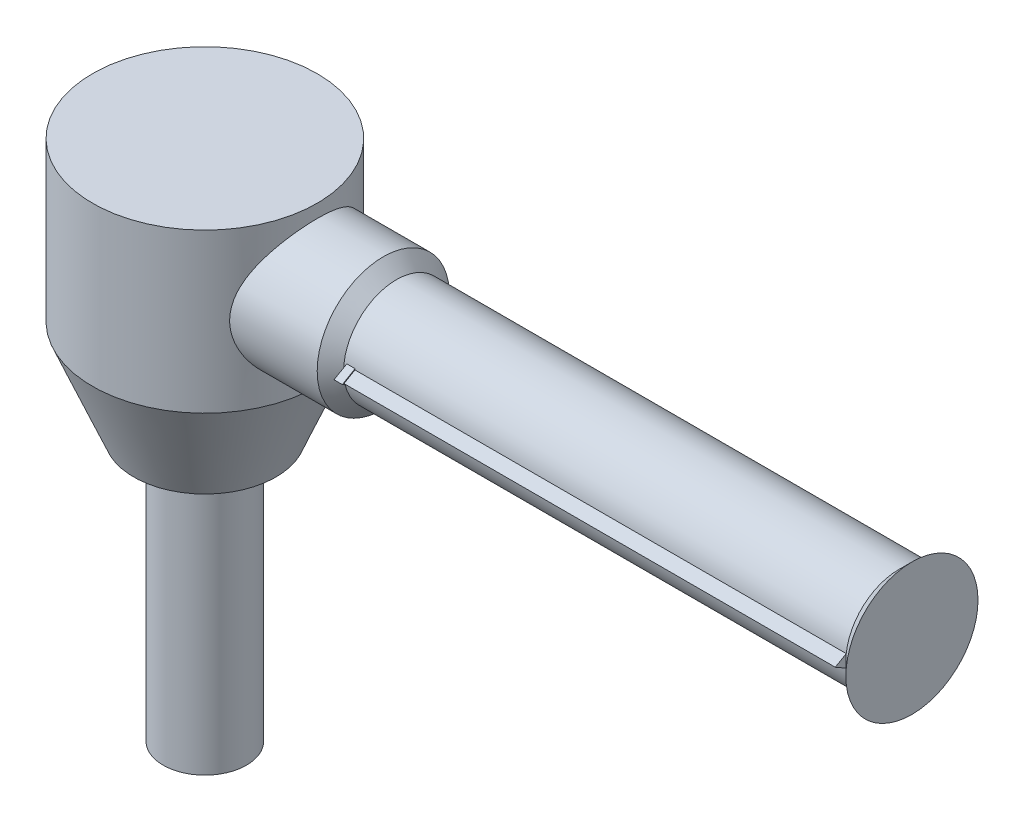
SolidWorks part; units mm, degrees
ref_plane "Front Plane" through (0, 0, 0) normal (0, 0, 1) x (1, 0, 0)
ref_plane "Top Plane" through (0, 0, 0) normal (0, 1, 0) x (1, 0, 0)
ref_plane "Right Plane" through (0, 0, 0) normal (1, 0, 0) x (0, 0, -1)
sketch "Sketch1" plane through (0, 0, 0) normal (0, 0, 1) x (1, 0, 0)
  line L0 (0, 0) -> (0, 61.9125) construction
  line L1 (0, 0) -> (17.0899, 0)
  line L2 (17.0899, 0) -> (26.9875, 23.8125)
  line L3 (26.9875, 23.8125) -> (26.9875, 61.9125)
  line L4 (26.9875, 61.9125) -> (0, 61.9125)
  line L5 (0, 61.9125) -> (0, 0)
  dimension "D1" = 61.9125
  dimension "D2" = 23.8125
  dimension "D3" = 53.975
  dimension "D4" = 34.1797
revolve "Revolve1" add sketch "Sketch1" angle 360 about L0
sketch "Sketch2" plane through (0, 0, 0) normal (0, 0, 1) x (1, 0, 0)
  line L0 (0, 0) -> (0, 61.9125) construction
  line L1 (26.9875, 61.9125) -> (-26.9875, 61.9125) construction
  line L2 (0, 58.7375) -> (42.8625, 58.7375)
  line L3 (42.8625, 58.7375) -> (46.0375, 55.5625)
  line L4 (46.0375, 55.5625) -> (166.6875, 55.5625)
  line L5 (166.6875, 55.5625) -> (169.8625, 58.7375)
  line L6 (0, 42.8625) -> (169.8625, 42.8625)
  line L7 (0, 42.8625) -> (169.8625, 42.8625) construction
  line L8 (0, 42.8625) -> (0, 58.7375)
  line L9 (169.8625, 42.8625) -> (169.8625, 58.7375)
  dimension "D1" = 46.0375
  dimension "D2" = 3.175
  dimension "D3" = 45
  dimension "D5" = 169.8625
  dimension "D6" = 169.8625
  dimension "D7" = 31.75
  dimension "D8" = 19.05
  dimension "D9" = 3.175
revolve "Revolve2" add sketch "Sketch2" angle 360 about L6
sketch "Sketch3" plane through (0, 0, 0) normal (0, -1, 0) x (1, 0, 0)
  circle A0 centre (0, 0) radius 3.2004
  circle A1 centre (0, 0) radius 14.5753
  circle A2 centre (0, 0) radius 11.9845
  circle A3 centre (0, 0) radius 17.0899 construction
  dimension "D1" = 6.4008
  dimension "D2" = 2.5146
  dimension "D3" = 2.5908
extrude "Cut-Extrude1" cut sketch "Sketch3" against normal blind 60.96 contours A1 A2 | A0
sketch "Sketch7" plane through (0, 0, 0) normal (0, -1, 0) x (1, 0, 0)
  circle A0 centre (0, 0) radius 10
  circle A1 centre (0, 0) radius 6
  dimension "D1" = 20
  dimension "D2" = 12
extrude "Boss-Extrude3" add sketch "Sketch7" along normal blind 63.5
ref_plane "Plane1" through (166.6875, 0, 0) normal (1, 0, 0) x (0, 0, -1)
sketch "Sketch5" plane through (166.6875, 0, 0) normal (1, 0, 0) x (0, 0, -1)
  line L0 (-12.6088, 44.3816) -> (-12.6088, 41.3434)
  line L1 (-15.24, 42.8625) -> (-12.6088, 44.3816)
  line L2 (-15.24, 42.8625) -> (-12.6088, 41.3434)
  line L3 (12.7, 42.8625) -> (15.155, 42.8625) construction
  line L4 (15.155, 42.8625) -> (12.615, 44.329)
  line L5 (15.155, 42.8625) -> (12.615, 41.396)
  line L6 (12.615, 44.329) -> (12.615, 41.396)
  circle A2 centre (0, 42.8625) radius 12.7 construction
  dimension "D1" = 60
  dimension "D4" = 60
  dimension "D3" = 2.54
  dimension "D2" = 15.24
  dimension "D5" = 3.0382
  dimension "D6" = 30
extrude "Boss-Extrude1" add sketch "Sketch5" against normal blind 120.015
sketch "Sketch6" plane through (46.6725, 0, 0) normal (-1, 0, 0) x (0, 0, 1)
  line L2 (-15.155, 42.8625) -> (-12.615, 41.396)
  line L3 (-12.615, 44.329) -> (-15.155, 42.8625)
  line L4 (-15.155, 42.8625) -> (-12.615, 41.396)
  line L5 (-12.615, 44.329) -> (-15.155, 42.8625)
  line L6 (12.6088, 41.3434) -> (15.24, 42.8625)
  line L7 (15.24, 42.8625) -> (12.6088, 44.3816)
  line L8 (12.6088, 41.3434) -> (15.24, 42.8625)
  line L9 (15.24, 42.8625) -> (12.6088, 44.3816)
  line L18 (12.3553, 40.9661) -> (15.64, 42.8625)
  line L19 (15.64, 42.8625) -> (12.3553, 44.7589)
  line L20 (12.3553, 40.9661) -> (15.64, 42.8625)
  line L21 (15.64, 42.8625) -> (12.3553, 44.7589)
  line L24 (-15.555, 42.8625) -> (-12.3634, 41.0198)
  line L25 (-12.3634, 44.7052) -> (-15.555, 42.8625)
  line L26 (-15.555, 42.8625) -> (-12.3634, 41.0198)
  line L27 (-12.3634, 44.7052) -> (-15.555, 42.8625)
  arc A1 (-12.615, 44.329) -> (-12.615, 41.396) centre (0, 42.8625) ccw
  arc A2 (-12.615, 44.329) -> (-12.615, 41.396) centre (0, 42.8625) ccw
  arc A3 (12.6088, 41.3434) -> (12.6088, 44.3816) centre (0, 42.8625) ccw
  arc A4 (12.6088, 41.3434) -> (12.6088, 44.3816) centre (0, 42.8625) ccw
  arc A9 (12.3553, 40.9661) -> (12.3553, 44.7589) centre (0, 42.8625) ccw
  arc A10 (12.3553, 40.9661) -> (12.3553, 44.7589) centre (0, 42.8625) ccw
  arc A12 (-12.3634, 44.7052) -> (-12.3634, 41.0198) centre (0, 42.8625) ccw
  arc A13 (-12.3634, 44.7052) -> (-12.3634, 41.0198) centre (0, 42.8625) ccw
  dimension "D1" = 0
  dimension "D2" = 0
  dimension "D4" = 0.2
  dimension "D5" = 0.2
extrude "Boss-Extrude2" add sketch "Sketch6" against normal blind 2
